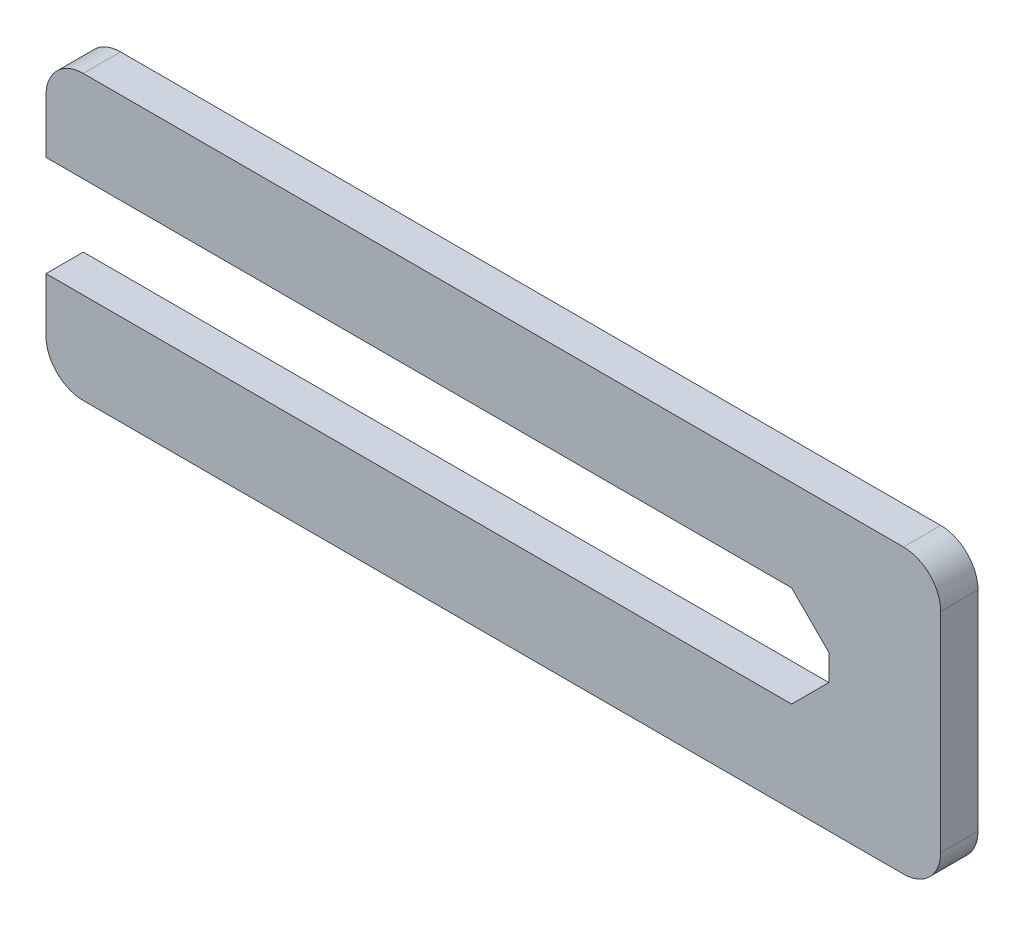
SolidWorks part; units mm, degrees
ref_plane "Plan de face" through (0, 0, 0) normal (0, 0, 1) x (1, 0, 0)
ref_plane "Plan de dessus" through (0, 0, 0) normal (0, 1, 0) x (1, 0, 0)
ref_plane "Plan de droite" through (0, 0, 0) normal (1, 0, 0) x (0, 0, -1)
sketch "Esquisse1" plane through (0, 0, 0) normal (0, 0, 1) x (1, 0, 0)
  line L1 (0, 0) -> (120, 0)
  line L2 (0, 0) -> (0, 38)
  line L3 (0, 38) -> (120, 38)
  line L4 (120, 0) -> (120, 38)
  dimension "D1" = 38
  dimension "D2" = 120
extrude "Extrusion1" add sketch "Esquisse1" along normal blind 5
sketch "Esquisse2" plane through (0, 0, 5) normal (0, 0, 1) x (1, 0, 0)
  line L0 (0, 38) -> (0, 0) construction
  line L1 (0, 25.75) -> (105, 25.75)
  line L2 (0, 25.75) -> (0, 12.25)
  line L3 (0, 12.25) -> (105, 12.25)
  line L4 (105, 25.75) -> (105, 12.25)
  line L5 (0, 0) -> (120, 0) construction
  line L6 (120, 0) -> (120, 38) construction
  dimension "D1" = 12.25
  dimension "D2" = 13.5
  dimension "D3" = 15
extrude "Extrusion2" cut sketch "Esquisse2" against normal blind 6
chamfer "Chanfrein1" distance 5 angle 45 2 edges at (105, 25.75, 2.5) (105, 12.25, 2.5)
fillet "Congé1" radius 5 4 edges at (120, 0, 2.5) (0, 0, 2.5) (0, 38, 2.5) (120, 38, 2.5)
